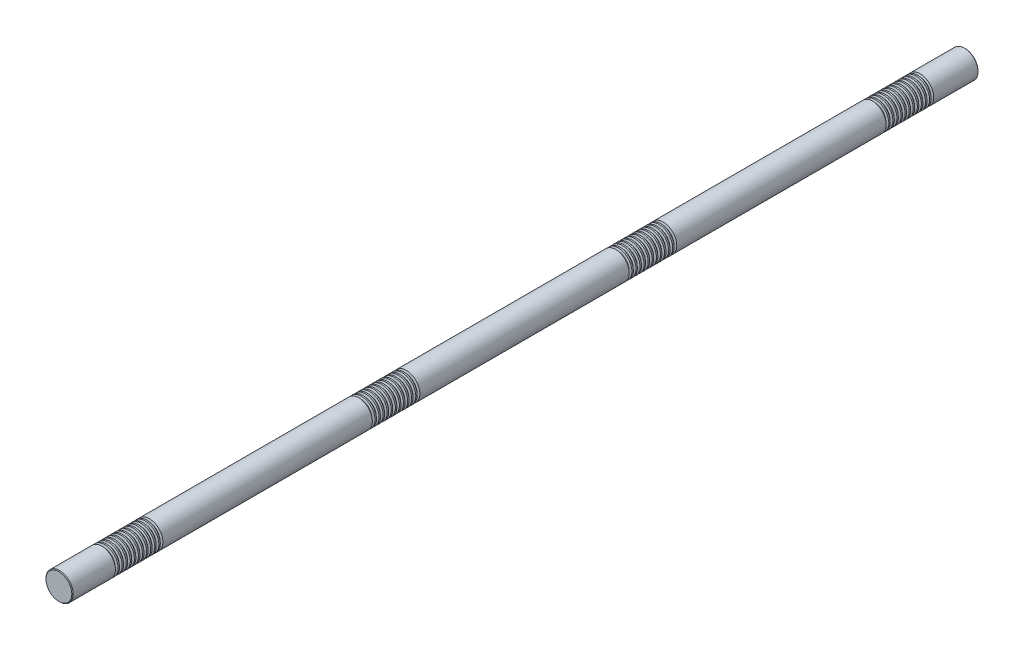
SolidWorks part; units mm, degrees
ref_plane "Front Plane" through (0, 0, 0) normal (0, 0, 1) x (1, 0, 0)
ref_plane "Top Plane" through (0, 0, 0) normal (0, 1, 0) x (1, 0, 0)
ref_plane "Right Plane" through (0, 0, 0) normal (1, 0, 0) x (0, 0, -1)
sketch "Sketch1" plane through (0, 0, 0) normal (0, 0, 1) x (1, 0, 0)
  circle A0 centre (0, 0) radius 30
  dimension "D1" = 60
extrude "Boss-Extrude1" add sketch "Sketch1" along normal mid plane 2000
chamfer "Chamfer1" distance 1.5 angle 45 2 edges at (30, 0, -1000) (30, 0, 1000)
sketch "Sketch2" plane through (0, 0, 0) normal (1, 0, 0) x (0, 0, -1)
  line L0 (900.6699, 30) -> (894.8301, 30)
  line L1 (998.5, 30) -> (-998.5, 30) construction
  line L2 (894.8301, 30) -> (896.1699, 25)
  line L3 (896.1699, 25) -> (899.3301, 25)
  line L4 (899.3301, 25) -> (900.6699, 30)
  line L5 (1000, -28.5) -> (1000, 28.5) construction
  point P4 (897.75, 30)
  point P7 (897.75, 25)
  point P8 (900, 27.5)
  point P9 (895.5, 27.5)
  dimension "D1" = 4.5
  dimension "D2" = 100
  dimension "D3" = 5
  dimension "D4" = 30
revolve "Cut-Revolve1" cut sketch "Sketch2" angle 360 about axis through (0, 0, 1000) along (0, 0, -1)
pattern_linear "LPattern1" count 12 spacing 9 along (0, 0, 1) of "Cut-Revolve1"
pattern_linear "LPattern2" count 4 spacing 567 along (0, 0, 1) of "Cut-Revolve1", "LPattern1"
